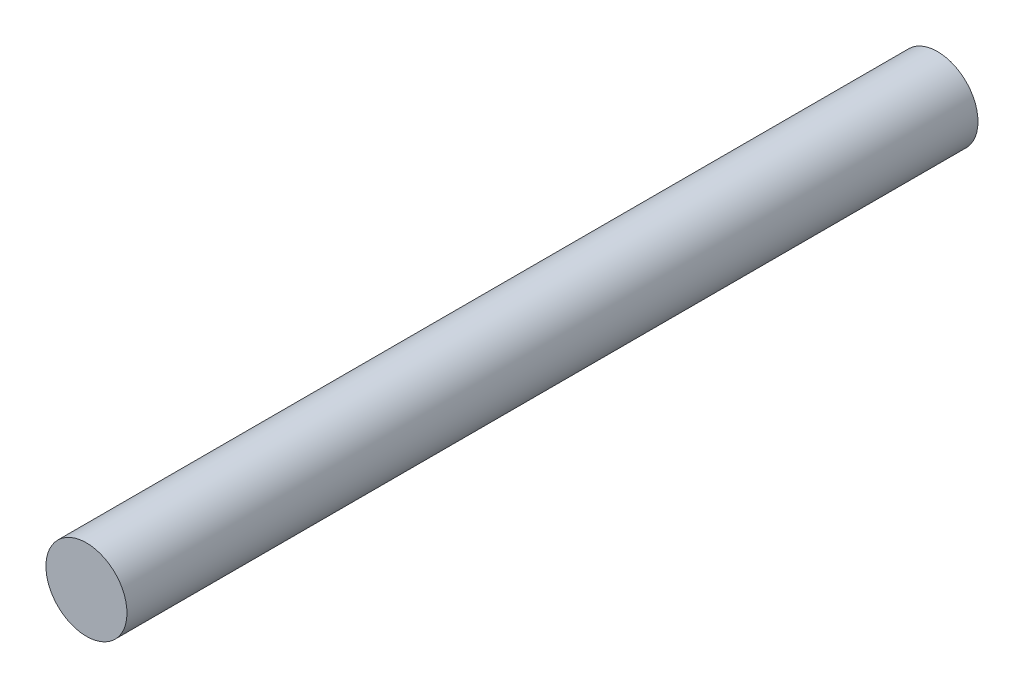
SolidWorks part; units mm, degrees
ref_plane "Piano frontale" through (0, 0, 0) normal (0, 0, 1) x (1, 0, 0)
ref_plane "Piano superiore" through (0, 0, 0) normal (0, 1, 0) x (1, 0, 0)
ref_plane "Piano destro" through (0, 0, 0) normal (1, 0, 0) x (0, 0, -1)
sketch "Schizzo1" plane through (0, 0, 0) normal (0, 0, 1) x (1, 0, 0)
  circle A0 centre (0, 0) radius 5
  dimension "D1" = 10
extrude "Estrusione-Estrusione1" add sketch "Schizzo1" along normal blind 85 and the other way blind 20
hole_wizard "Foro filettato M6-1" positions "Schizzo3D5" profile "Schizzo3" tap size "M6" standard "ISO"
sketch3d "Schizzo3D5"
  circle A0 centre (0, 0, -20) radius 5 construction
  point P0 (0, 0, 0)
  point P6 (0, 0, -20)
  point P11 (0, 0, -15)
  dimension "D1" = 0
sketch "Schizzo3" plane through (0, 0, -20) normal (1, 0, 0) x (0, 1, 0)
  line L0 (0, 0) -> (0, 17)
  line L1 (0, 17) -> (2.5, 15.4978)
  line L2 (2.5, 15.4978) -> (2.5, 0)
  line L5 (2.5, 0) -> (0, 0)
  line L10 (0, 17) -> (-2.5, 15.4978) construction
  line L11 (0, -6.35) -> (0, 107.95) construction
  dimension "Tap Drill Dia." = 5
  dimension "Tap Drill Depth" = 17
  dimension "Drill Angle" = 118
